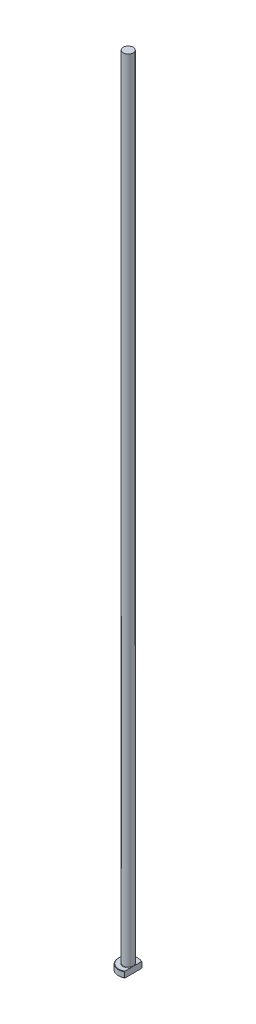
SolidWorks part; units mm, degrees
ref_plane "Front Plane" through (0, 0, 0) normal (0, 0, 1) x (1, 0, 0)
ref_plane "Top Plane" through (0, 0, 0) normal (0, 1, 0) x (1, 0, 0)
ref_plane "Right Plane" through (0, 0, 0) normal (1, 0, 0) x (0, 0, -1)
sketch "Sketch1" plane through (0, 0, 0) normal (0, 0, 1) x (1, 0, 0)
  line L0 (0, 259.9588) -> (0, -15.1925) construction
  line L1 (0, 0) -> (-5, 0)
  line L2 (-5, 0) -> (-5, 3)
  line L3 (-5, 3) -> (-2.5, 3)
  line L4 (-2.5, 3) -> (-2.5, 400)
  line L5 (-2.5, 400) -> (0, 400)
  line L6 (0, 400) -> (0, 0)
  dimension "L" = 400
  dimension "H" = 10
  dimension "T" = 3
  dimension "D" = 5
revolve "Revolve1" add sketch "Sketch1" angle 360 about L0
chamfer "Chamfer1" distance 0.2 angle 45 2 edges at (0, 3, 5) (0, 0, 5)
fillet "Fillet1" radius 0.2 1 edges at (0, 3, 2.5)
sketch "Sketch2" plane through (0, 0, 0) normal (0, 1, 0) x (1, 0, 0)
  line L0 (2.5, 4.3301) -> (2.5, -4.3301)
  circle A0 centre (0, 0) radius 5 construction
  arc A1 (2.5, -4.3301) -> (2.5, 4.3301) centre (0, 0) ccw
  circle A2 centre (0, 0) radius 2.5 construction
extrude "KEY" cut sketch "Sketch2" along normal through all
